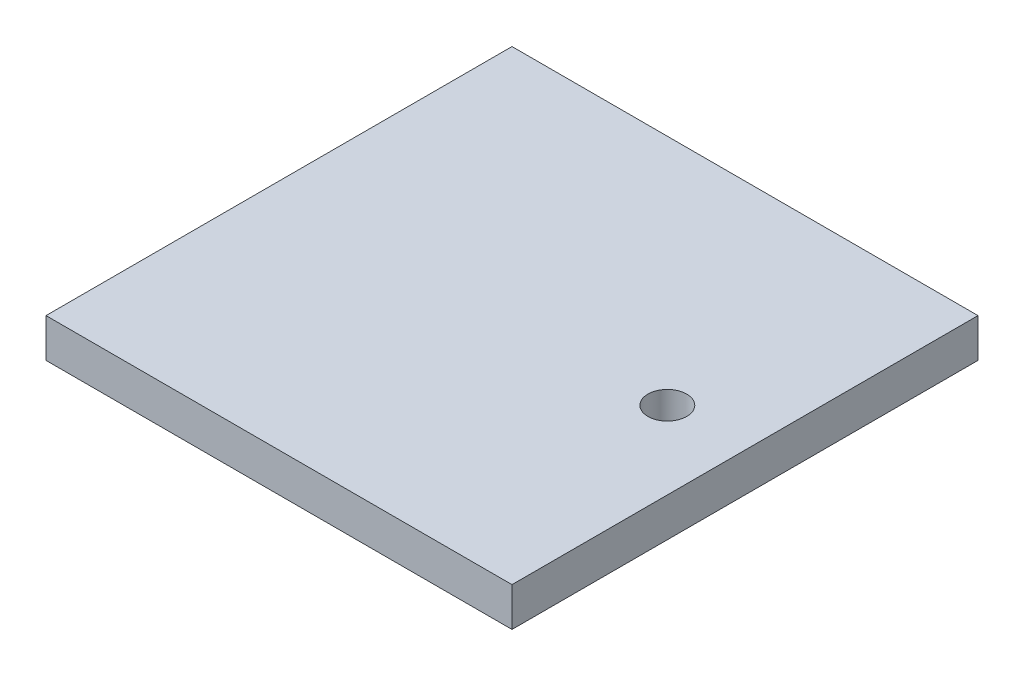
SolidWorks part; units mm, degrees
ref_plane "Front Plane" through (0, 0, 0) normal (0, 0, 1) x (1, 0, 0)
ref_plane "Top Plane" through (0, 0, 0) normal (0, 1, 0) x (1, 0, 0)
ref_plane "Right Plane" through (0, 0, 0) normal (1, 0, 0) x (0, 0, -1)
sketch "Sketch1" plane through (0, 0, 0) normal (0, 1, 0) x (1, 0, 0)
  line L1 (-35.574, 62.7783) -> (40.626, 62.7783)
  line L2 (-35.574, 62.7783) -> (-35.574, -13.4217)
  line L3 (-35.574, -13.4217) -> (40.626, -13.4217)
  line L4 (40.626, 62.7783) -> (40.626, -13.4217)
  circle A0 centre (27.926, 24.6783) radius 3.175
  dimension "D3" = 6.35
  dimension "D4" = 38.1
  dimension "D5" = 12.7
  dimension "D1" = 76.2
  dimension "D2" = 76.2
extrude "Extrude1" add sketch "Sketch1" along normal blind 6.35
